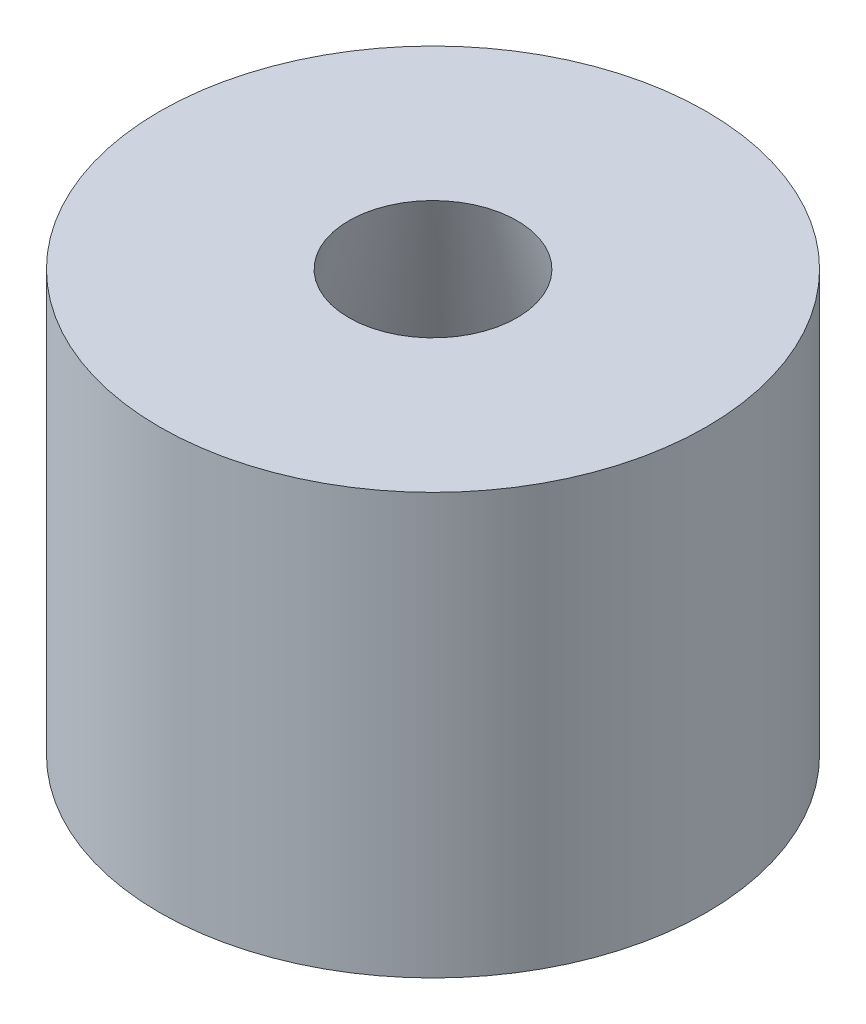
SolidWorks part; units mm, degrees
ref_plane "Plane1" through (0, 0, 0) normal (0, 0, 1) x (1, 0, 0)
ref_plane "Plane2" through (0, 0, 0) normal (0, 1, 0) x (1, 0, 0)
ref_plane "Plane3" through (0, 0, 0) normal (1, 0, 0) x (0, 0, -1)
sketch "Sketch1" plane through (0, 0, 0) normal (0, 0, 1) x (1, 0, 0)
  line L0 (12.7, 0) -> (41.275, 0)
  line L1 (41.275, 0) -> (41.275, -63.5)
  line L2 (41.275, -63.5) -> (31.75, -63.5)
  line L3 (31.75, -63.5) -> (12.7, 0)
  line L4 (0, 44.9508) -> (0, -103.8636) construction
  dimension "D1" = 41.275
  dimension "D2" = 31.75
  dimension "D3" = 28.575
  dimension "D4" = 63.5
revolve "Base-Revolve" add sketch "Sketch1" angle 360 about L4
